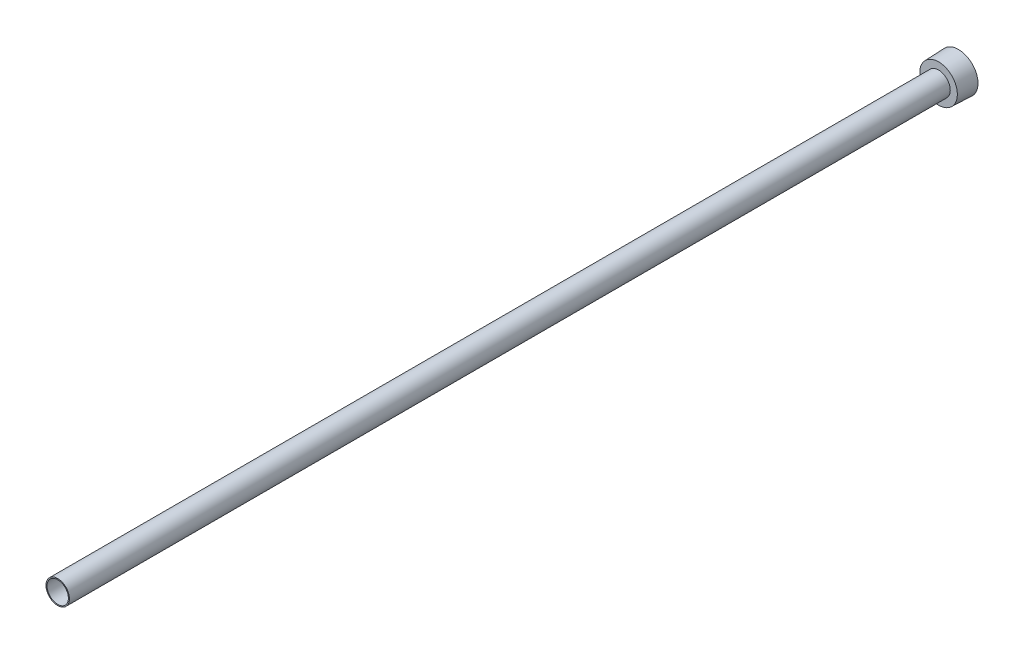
SolidWorks part; units mm, degrees
ref_plane "Front Plane" through (0, 0, 0) normal (0, 0, 1) x (1, 0, 0)
ref_plane "Top Plane" through (0, 0, 0) normal (0, 1, 0) x (1, 0, 0)
ref_plane "Right Plane" through (0, 0, 0) normal (1, 0, 0) x (0, 0, -1)
sketch "Sketch1" plane through (0, 0, 0) normal (1, 0, 0) x (0, 0, -1)
  line L0 (-278.0011, 0) -> (49721.9989, 0) construction
  line L1 (-609.6, 0) -> (0, 0)
  line L6 (0, 0) -> (0, 13.2207)
  line L7 (0, 13.2207) -> (-13.4874, 12.7287)
  line L8 (-13.4874, 12.7287) -> (-13.4874, 7.9375)
  line L9 (-13.4874, 7.9375) -> (-609.6, 7.9375)
  line L10 (-609.6, 7.9375) -> (-609.6, 0)
  dimension "D1" = 13.4874
  dimension "D2" = 26.4414
  dimension "D3" = 2.089
  dimension "D4" = 15.875
  dimension "D5" = 609.6
revolve "Revolve1" add sketch "Sketch1" angle 360 about L0
sketch "Sketch2" plane through (0, 0, 609.6) normal (0, 0, 1) x (1, 0, 0)
  circle A0 centre (0, 0) radius 7.2263
  dimension "D1" = 14.4526
extrude "Cut-Extrude1" cut sketch "Sketch2" against normal through all
sketch "Sketch3" plane through (0, 0, 0) normal (0, 0, -1) x (-1, 0, 0)
  line L0 (0, 14.5428) -> (0, -14.5428) construction
  line L1 (0, -10.9985) -> (9.525, -5.4993)
  line L2 (9.525, -5.4993) -> (9.525, 5.4993)
  line L3 (9.525, 5.4993) -> (0, 10.9985)
  line L4 (0, 10.9985) -> (-9.525, 5.4993)
  line L5 (-9.525, 5.4993) -> (-9.525, -5.4993)
  line L6 (-9.525, -5.4993) -> (0, -10.9985)
  circle A0 centre (0, 0) radius 9.525 construction
  dimension "D1" = 19.05
extrude "Cut-Extrude2" cut sketch "Sketch3" against normal blind 9.525
